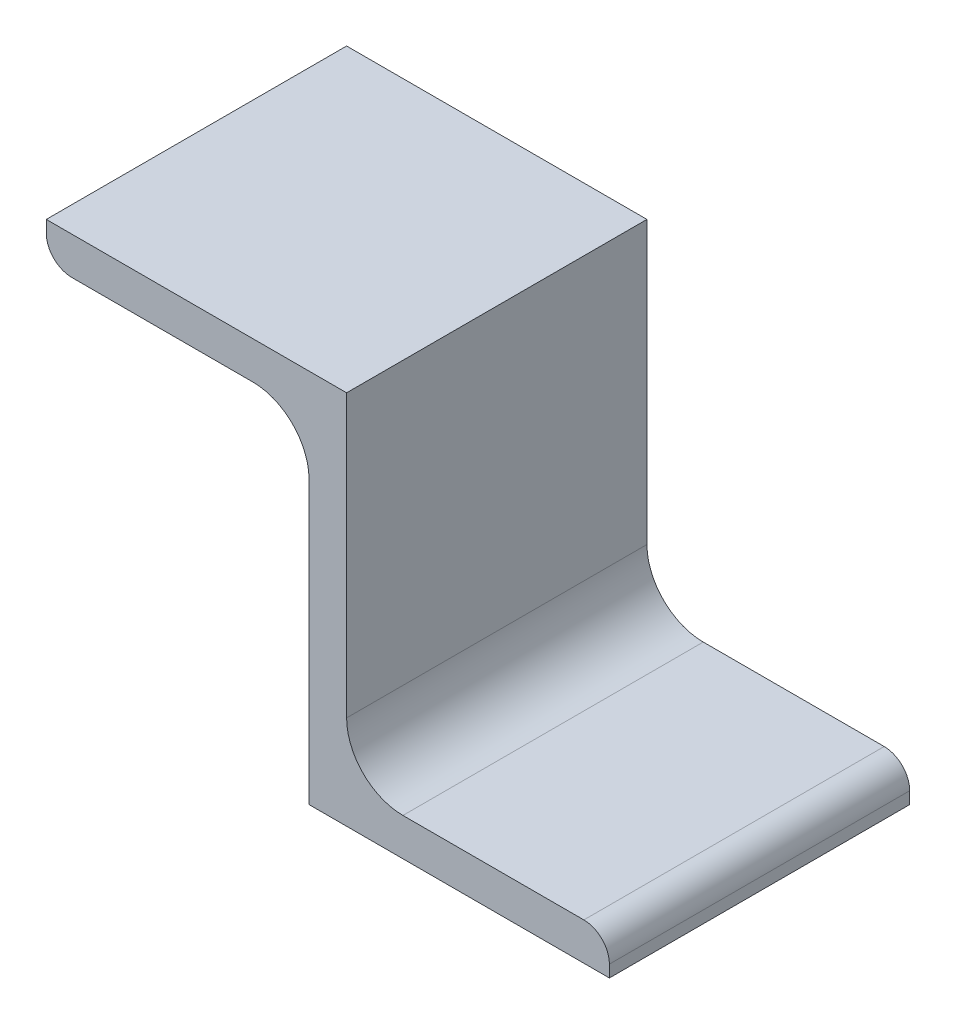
SolidWorks part; units mm, degrees
ref_plane "Plane1" through (0, 0, 0) normal (0, 0, 1) x (1, 0, 0)
ref_plane "Plane2" through (0, 0, 0) normal (0, 1, 0) x (-1, 0, 0)
ref_plane "Plane3" through (0, 0, 0) normal (1, 0, 0) x (0, 0, -1)
other "Configuration Table"
sketch "Sketch1" plane through (0, 0, 0) normal (0, 0, 1) x (1, 0, 0)
  line L0 (0, 0) -> (0, 23.8125)
  line L1 (15.6984, 0) -> (-15.6984, 0) construction
  line L2 (0, 0) -> (25.4, 0)
  line L3 (23.241, 3.175) -> (7.9375, 3.175)
  line L4 (3.175, 31.75) -> (3.175, 7.9375)
  line L5 (0, -15.6984) -> (0, 15.6984) construction
  line L6 (-22.225, 31.75) -> (3.175, 31.75)
  line L7 (25.4, 0) -> (25.4, 1.016)
  line L8 (-20.066, 28.575) -> (-4.7625, 28.575)
  line L9 (-22.225, 30.734) -> (-22.225, 31.75)
  arc A0 (0, 23.8125) -> (-4.7625, 28.575) centre (-4.7625, 23.8125) ccw
  arc A1 (3.175, 7.9375) -> (7.9375, 3.175) centre (7.9375, 7.9375) ccw
  arc A2 (25.4, 1.016) -> (23.241, 3.175) centre (23.241, 1.016) ccw
  arc A3 (-22.225, 30.734) -> (-20.066, 28.575) centre (-20.066, 30.734) ccw
  dimension "d" = 31.75
extrude "Base-Zee" add sketch "Sketch1" along normal mid plane 25.4
